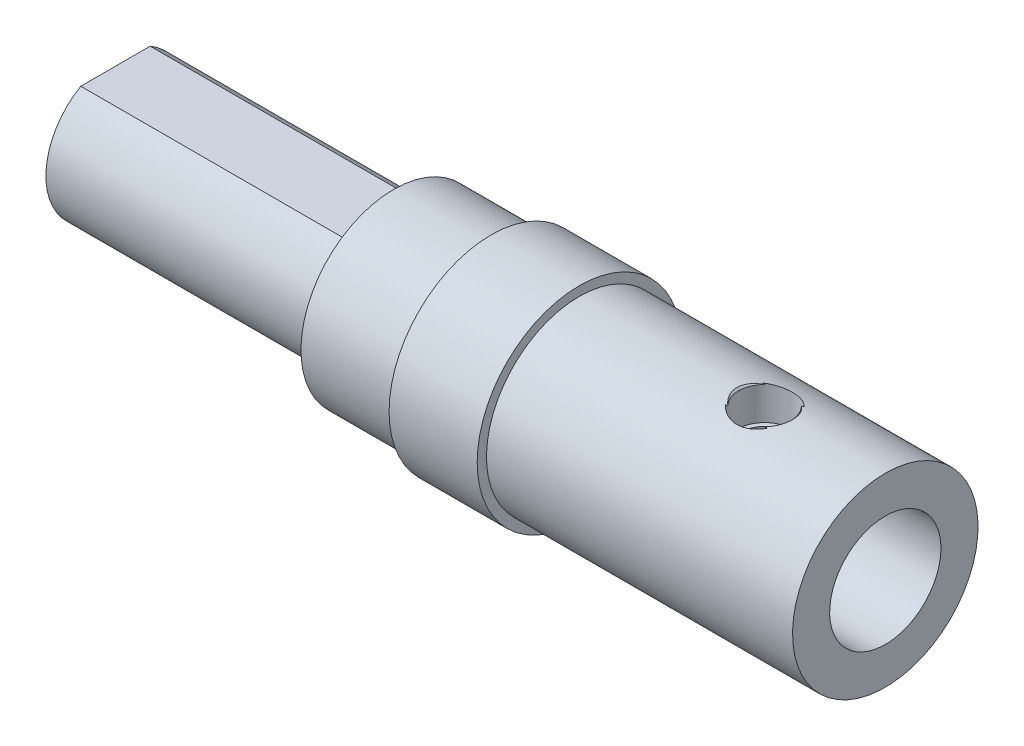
SolidWorks part; units mm, degrees
ref_plane "Face" through (0, 0, 0) normal (0, 0, 1) x (1, 0, 0)
ref_plane "Dessus" through (0, 0, 0) normal (0, 1, 0) x (1, 0, 0)
ref_plane "Droite" through (0, 0, 0) normal (1, 0, 0) x (0, 0, -1)
sketch "Esquisse1" plane through (0, 0, 0) normal (0, 0, 1) x (1, 0, 0)
  line L0 (-85, 7.5) -> (-55, 7.5)
  line L1 (-55, 7.5) -> (-55, 10)
  line L2 (-55, 10) -> (-44.5, 10)
  line L3 (-44.5, 10) -> (-44.5, 11)
  line L4 (-44.5, 11) -> (-35, 11)
  line L5 (-35, 11) -> (-35, 10)
  line L6 (-35, 10) -> (-2, 10)
  line L7 (-2, 10) -> (-2, 0)
  line L8 (-58, 0) -> (192, 0) construction
  line L9 (-2, 0) -> (-85, 0)
  line L10 (-85, 0) -> (-85, 7.5)
  line L11 (-88, 7.5) -> (-76.4, 7.5) construction
  line L12 (-51.2, 10) -> (-44.8, 10) construction
  line L13 (-35, 15.7) -> (-35, 10.3) construction
  line L14 (-34.7, 10) -> (-28.3, 10) construction
  line L15 (0, 6) -> (0, 0) construction
  line L16 (-44.5, 15.7) -> (-44.5, 10.3) construction
  line L17 (-2, 0) -> (-85, 0) construction
  dimension "D1" = 2
  dimension "D2" = 1
  dimension "D3" = 10.5
  dimension "D4" = 30
revolve "Révolution1" add sketch "Esquisse1" angle 360 about L17
sketch "Esquisse2" plane through (0, 0, 0) normal (0, 0, 1) x (1, 0, 0)
  line L0 (-58, 0) -> (192, 0) construction
  line L1 (0, 6) -> (-27, 6)
  line L2 (0, 6) -> (0, 0)
  line L3 (0, 0) -> (-27, 0)
  line L4 (-27, 6) -> (-27, 0)
  line L5 (-25, 0) -> (-25, 6) construction
  line L6 (0, 0) -> (-27, 0) construction
  dimension "D1" = 2
revolve "Enlèvement de matière-Révolution1" cut sketch "Esquisse2" angle 360 about L6
hole_wizard "Diamètre du perçage M10.0 (10.000000)1" positions "Esquisse4" profile "Esquisse3" hole size "M10.0" standard "ISO"
sketch "Esquisse4" plane through (-2, 0, 0) normal (1, 0, 0) x (0, 0, -1)
  point P0 (0, 0)
sketch "Esquisse3" plane through (-2, 0, 0) normal (0, 1, 0) x (0, 0, -1)
  line L0 (0, 0) -> (0, 28.0043)
  line L1 (0, 28.0043) -> (5, 25)
  line L2 (5, 25) -> (5, 0)
  line L5 (5, 0) -> (0, 0)
  line L10 (0, 28.0043) -> (-5, 25) construction
  line L11 (0, -6.35) -> (0, 107.95) construction
  dimension "Diamètre du perçage" = 10
  dimension "Profondeur du perçage" = 25
  dimension "Angle de pointe" = 118
sketch "Esquisse5" plane through (0, 0, 0) normal (0, 0, 1) x (1, 0, 0)
  line L0 (-85, 0) -> (-85, 7.5) construction
  line L1 (-85, 7.5) -> (-55, 7.5)
  line L2 (-85, 7.5) -> (-85, 6.5)
  line L3 (-85, 6.5) -> (-55, 6.5)
  line L4 (-55, 7.5) -> (-55, 6.5)
  dimension "D1" = 1
extrude "Enlèv. mat.-Extru.1" cut sketch "Esquisse5" against normal through all and the other way through all
sketch "Esquisse6" plane through (0, 0, 0) normal (0, 0, 1) x (1, 0, 0)
  line L0 (-15, 5.5) -> (-15, 10) construction
  line L1 (-35, 10) -> (-2, 10) construction
ref_plane "Plan1" through (-15, 10, 0) normal (0, 1, 0) x (-1, 0, 0)
hole_wizard "Trou taraudé M6x1.01" positions "Esquisse8" profile "Esquisse7" tap size "M6x1.0" standard "ISO"
sketch "Esquisse8" plane through (-15, 10, 0) normal (0, 1, 0) x (-1, 0, 0)
  point P0 (0, 0)
sketch "Esquisse7" plane through (-15, 10, 0) normal (1, 0, 0) x (0, 0, 1)
  line L0 (0, 0) -> (0, 4)
  line L1 (0, 4) -> (2.5, 4)
  line L2 (2.5, 4) -> (2.5, 0.5)
  line L3 (2.5, 0.5) -> (3, 0)
  line L5 (3, 0) -> (0, 0)
  line L6 (-2.5, 0.5) -> (-3, 0) construction
  line L11 (0, -6.35) -> (0, 107.95) construction
  dimension "Diamètre du trou pour taraudage jusqu'au prochain" = 5
  dimension "Profondeur du trou pour taraudage jusqu'au prochain" = 4
  dimension "Diamètre du fraisage entrant" = 6
  dimension "Angle du fraisage entrant" = 90
sketch "Esquisse10" plane through (0, 0, 0) normal (0, 0, 1) x (1, 0, 0)
  line L0 (-12, 6) -> (-12, 10.9) construction
  line L1 (-12, 9.8) -> (-12.5, 9.8)
  line L2 (-12, 9.8) -> (-12, 6.1)
  line L3 (-12, 6.1) -> (-12.5, 6.1)
  line L4 (-12.5, 9.8) -> (-12.5, 6.1)
  line L6 (-35, 10) -> (-2, 10) construction
  line L7 (-15, 10) -> (-15, 5.5) construction
  line L8 (-25, 6) -> (0, 6) construction
  dimension "D1" = 0.2
  dimension "D2" = 0.1
revolve "Enlèvement de matière-Révolution2" cut sketch "Esquisse10" angle 360 about L7
sketch "Esquisse9" plane through (0, 0, 0) normal (0, 0, 1) x (1, 0, 0)
  line L0 (-35, 10) -> (-2, 10) construction
  line L2 (-35, -10) -> (-2, -10) construction
  line L3 (-30, -10) -> (-2, -10)
  line L5 (-2, -10) -> (-2, 10)
  line L6 (-2, 10) -> (-31, 10)
  line L8 (-27, 6) -> (-27, 0) construction
  line L9 (-2, 0) -> (-85, 0) construction
  spline_without_curve S0
  dimension "D1" = 2
  dimension "D2" = 5
  dimension "D3" = 4
  dimension "D4" = 5
  dimension "D5" = 3
extrude "Enlèv. mat.-Extru.2" [suppressed] cut sketch "Esquisse9" along normal through all
